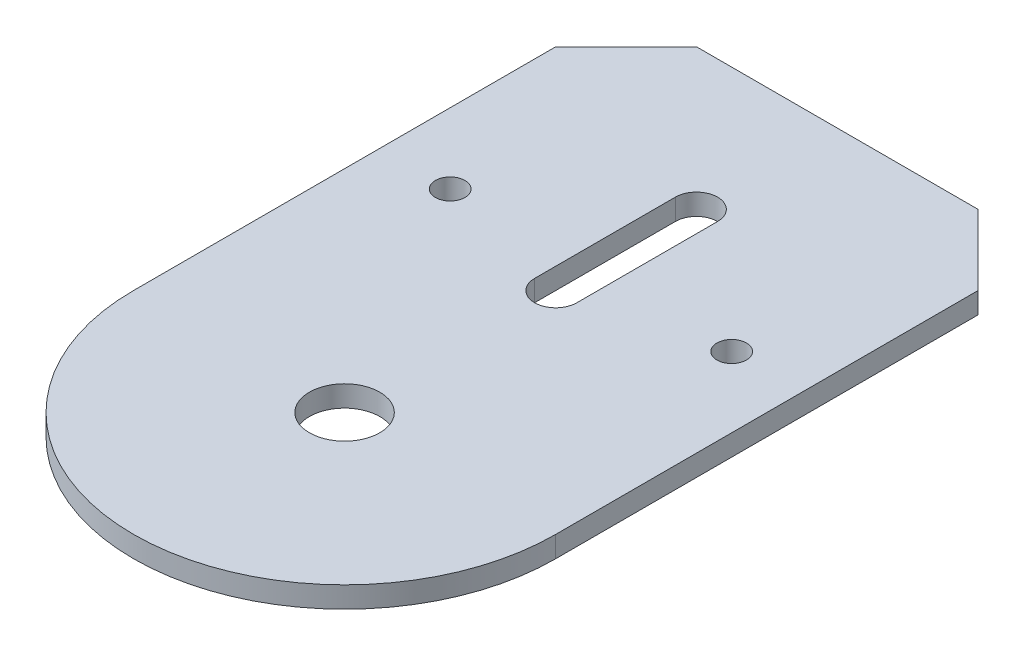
SolidWorks part; units mm, degrees
ref_plane "Front Plane" through (0, 0, 0) normal (0, 0, 1) x (1, 0, 0)
ref_plane "Top Plane" through (0, 0, 0) normal (0, 1, 0) x (1, 0, 0)
ref_plane "Right Plane" through (0, 0, 0) normal (1, 0, 0) x (0, 0, -1)
sketch "Sketch1" plane through (0, 0, 0) normal (0, 1, 0) x (1, 0, 0)
  line L0 (0, 30) -> (0, 50) construction
  line L1 (-30, 0) -> (-30, 60)
  line L2 (-20, 70) -> (20, 70)
  line L3 (30, 60) -> (30, 0)
  line L4 (3, 30) -> (3, 50)
  line L5 (-3, 30) -> (-3, 50)
  line L6 (-30, 60) -> (-20, 70)
  line L7 (20, 70) -> (30, 60)
  line L8 (0, 0) -> (0, 30) construction
  circle A0 centre (0, 0) radius 5
  arc A1 (-30, 0) -> (30, 0) centre (0, 0) ccw
  arc A2 (3, 30) -> (-3, 30) centre (0, 30) cw
  arc A3 (3, 50) -> (-3, 50) centre (0, 50) ccw
  point P7 (-30, 70)
  point P9 (30, 70)
  dimension "D3" = 20
  dimension "D4" = 30
  dimension "D5" = 10
  dimension "D7" = 30
  dimension "D6" = 70
  dimension "D10" = 10
  dimension "D11" = 10
  dimension "D1" = 3
  dimension "D2" = 3
extrude "Extrude1" add sketch "Sketch1" along normal blind 3
sketch "Sketch2" plane through (0, 3, 0) normal (0, 1, 0) x (1, 0, 0)
  line L0 (30, 0) -> (30, 60) construction
  line L1 (-30, 60) -> (-30, 0) construction
  line L2 (20, 70) -> (-20, 70) construction
  point P0 (-20, 35)
  point P1 (20, 35)
  dimension "D1" = 10
  dimension "D2" = 10
  dimension "D3" = 35
  dimension "D4" = 35
hole_wizard "M5 Tapped Hole1" positions "3DSketch1" profile "Sketch3" tap size "M5" standard "ISO"
sketch3d "3DSketch1"
  point P0 (-20, 3, -35)
  point P3 (20, 3, -35)
sketch "Sketch3" plane through (-20, 3, -35) normal (1, 0, 0) x (0, 0, 1)
  line L0 (0, 0) -> (0, 3)
  line L1 (0, 3) -> (2.1, 3)
  line L2 (2.1, 3) -> (2.1, 0)
  line L5 (2.1, 0) -> (0, 0)
  line L11 (0, -6.35) -> (0, 107.95) construction
  dimension "Thru Tap Drill Dia." = 4.2
  dimension "Thru Tap Drill Depth" = 3
